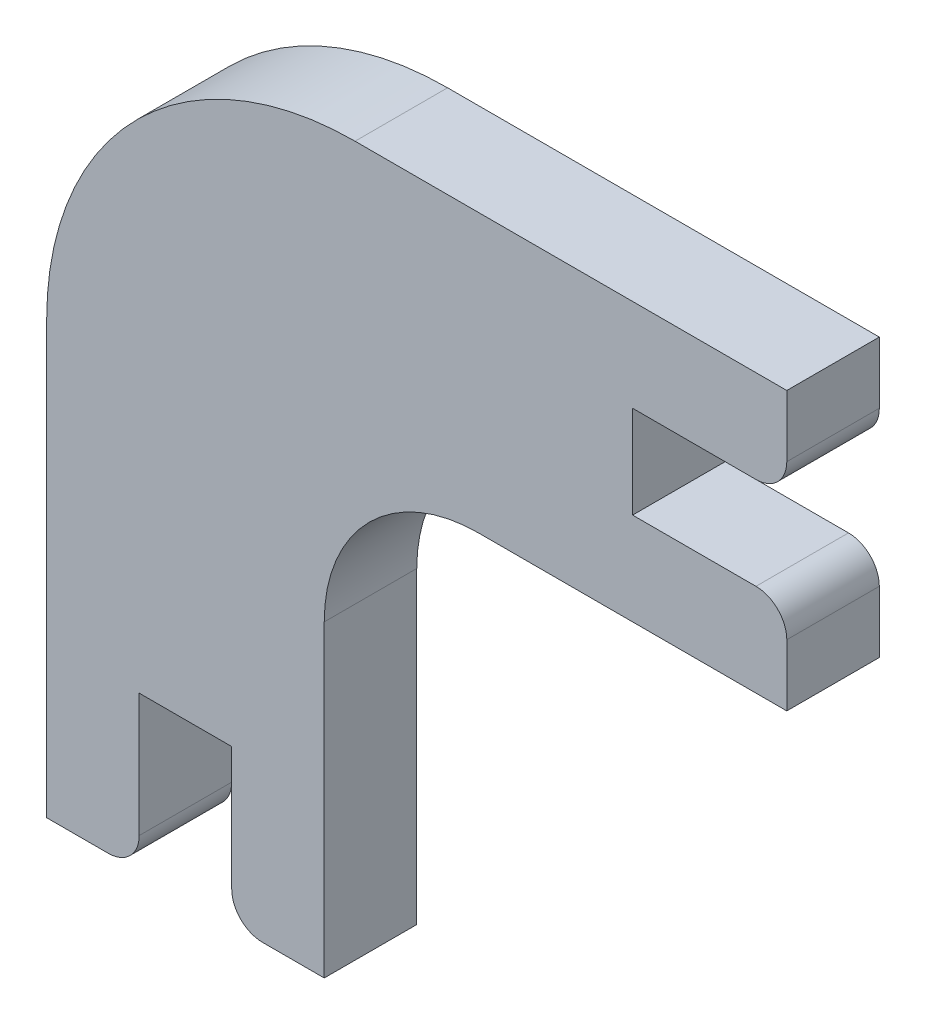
SolidWorks part; units mm, degrees
ref_plane "Alzado" through (0, 0, 0) normal (0, 0, 1) x (1, 0, 0)
ref_plane "Planta" through (0, 0, 0) normal (0, 1, 0) x (1, 0, 0)
ref_plane "Vista lateral" through (0, 0, 0) normal (1, 0, 0) x (0, 0, -1)
sketch "Croquis1" plane through (0, 0, 0) normal (0, 0, 1) x (1, 0, 0)
  line L0 (0, 0) -> (-30, 0)
  line L1 (-30, 0) -> (-30, -30)
  line L2 (0, 18) -> (-48, 18)
  line L3 (-48, 18) -> (-48, -30)
  line L4 (0, 0) -> (0, 6)
  line L5 (-30, -30) -> (-36, -30)
  line L12 (-42, -30) -> (-48, -30)
  line L13 (0, 6) -> (-10, 6)
  line L15 (0, 12) -> (-10, 12)
  line L16 (-10, 6) -> (-10, 12)
  line L17 (17.7834, 7) -> (-10, 12) construction
  line L18 (17.7834, 7) -> (-10, 6) construction
  line L19 (-56, -80) -> (-54, -80)
  line L20 (-42, -30) -> (-42, -20)
  line L21 (-42, -20) -> (-36, -20)
  line L22 (-36, -30) -> (-36, -20)
  line L23 (-39, -30) -> (-36, -20) construction
  line L24 (-42, -20) -> (-39, -30) construction
  line L25 (-42, -30) -> (-36, -30) construction
  line L26 (0, 12) -> (0, 18)
  line L27 (0, 12) -> (0, 6) construction
  point P7 (0, 9)
  point P12 (17.7834, 7)
  point P17 (-39, -30)
  point P26 (-39, -30)
extrude "Saliente-Extruir1" add sketch "Croquis1" along normal mid plane 6 contours L2 L3 L12 L20 L21 L22 L5 L1 L0 L4 L13 L16 L15 L26
fillet "Redondeo1" radius 20 1 edges at (-48, 18, 0)
fillet "Redondeo2" radius 10 1 edges at (-30, 0, 0)
fillet "Redondeo3" radius 2 4 edges at (-36, -30, 0) (-42, -30, 0) (0, 6, 0) (0, 12, 0)
equation "\"D1@Saliente-Extruir1\"=\"thickness@Croquis1\""
equation "\"D2@Croquis1\"=\"thickness@Croquis1\""
